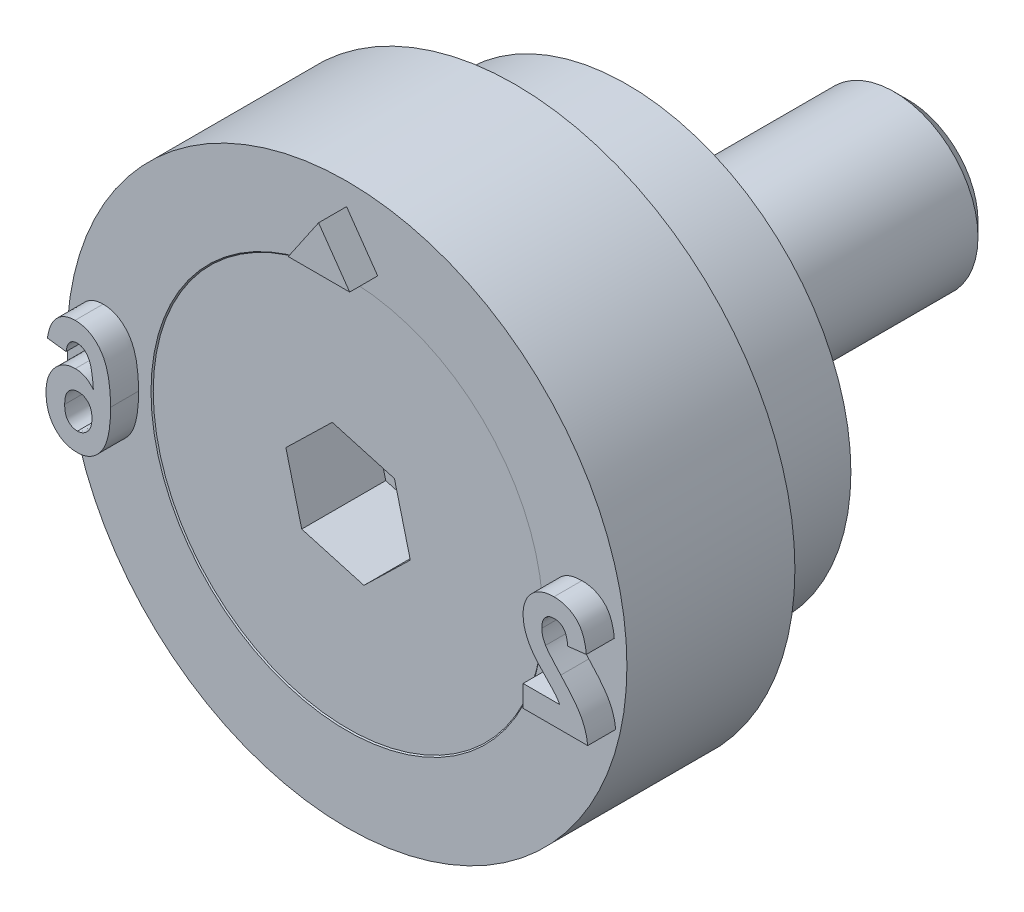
SolidWorks part; units mm, degrees
other "<M3 X .5 FHCS>-<Imported1>"
ref_plane "Front Plane" through (0, 0, 0) normal (0, 0, 1) x (1, 0, 0)
ref_plane "Top Plane" through (0, 0, 0) normal (0, 1, 0) x (1, 0, 0)
ref_plane "Right Plane" through (0, 0, 0) normal (1, 0, 0) x (0, 0, -1)
imported_body "Imported1"
other "DeleteFace1"
sketch "Sketch1" plane through (0, 0, 0) normal (0, 0, 1) x (1, 0, 0)
  line L0 (-0.0071, 4.6037) -> (-0.5487, 3.81)
  line L1 (-0.5487, 3.81) -> (0.5487, 3.81)
  line L2 (0.5487, 3.81) -> (-0.0071, 4.6037)
  text T0 "2             6" font "Arial" height 2
  dimension "D1" = 1.0795
  dimension "D2" = 4.9022
extrude "Boss-Extrude1" add sketch "Sketch1" along normal blind 0.5
inserted part "M3 X .5 FHCS"
move or copy body "Body-Move/Copy2" placed by mates yes
